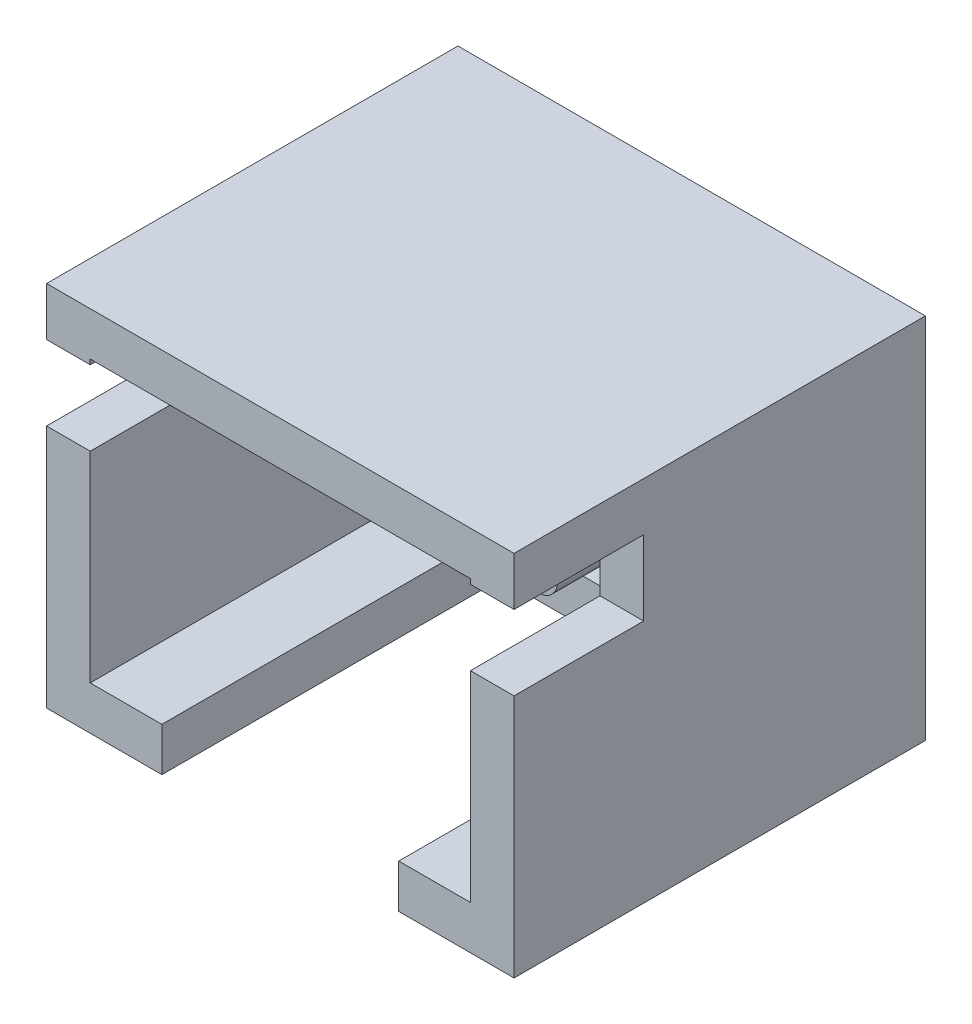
SolidWorks part; units mm, degrees
ref_plane "Face" through (0, 0, 0) normal (0, 0, 1) x (1, 0, 0)
ref_plane "Dessus" through (0, 0, 0) normal (0, 1, 0) x (1, 0, 0)
ref_plane "Droite" through (0, 0, 0) normal (1, 0, 0) x (0, 0, -1)
sketch "Esquisse1" plane through (0, 0, 0) normal (0, 0, 1) x (1, 0, 0)
  line L1 (26.7272, -1.2) -> (34.2272, -1.2)
  line L2 (26.7272, -1.2) -> (26.7272, 4.7)
  line L3 (26.7272, 4.7) -> (34.2272, 4.7)
  line L4 (34.2272, -1.2) -> (34.2272, 4.7)
  dimension "D1" = 5.9
  dimension "D2" = 7.5
extrude "Extrusion1" add sketch "Esquisse1" along normal blind 6.6
shell "Coque1" thickness 0.7
sketch "Esquisse2" plane through (34.2272, 0, 0) normal (1, 0, 0) x (0, 0, -1)
  line L0 (-6.6, -1.2) -> (-6.6, 4.7) construction
  line L1 (-6.6, 2.7202) -> (-4.5204, 2.7202)
  line L2 (-6.6, 2.7202) -> (-6.6, 3.9202)
  line L3 (-6.6, 3.9202) -> (-4.5204, 3.9202)
  line L4 (-4.5204, 2.7202) -> (-4.5204, 3.9202)
  line L5 (0, 1.75) -> (-5.6635, 1.75) construction
  line L6 (0, -1.2) -> (0, 4.7) construction
  dimension "D1" = 1.2
  dimension "D2" = 2.0796
extrude "Enlèv. mat.-Extru.1" cut sketch "Esquisse2" against normal through all
sketch "Esquisse3" plane through (0, -1.2, 0) normal (0, -1, 0) x (1, 0, 0)
  line L0 (26.7272, 6.6) -> (34.2272, 6.6) construction
  line L1 (28.5772, 6.6) -> (32.3772, 6.6)
  line L2 (28.5772, 6.6) -> (28.5772, 1.1619)
  line L3 (28.5772, 1.1619) -> (32.3772, 1.1619)
  line L4 (32.3772, 6.6) -> (32.3772, 1.1619)
  line L5 (30.4772, 0) -> (30.4772, 4.8072) construction
  line L6 (26.7272, 0) -> (34.2272, 0) construction
  point P6 (30.4772, 6.6)
  dimension "D1" = 3.8
extrude "Enlèv. mat.-Extru.2" cut sketch "Esquisse3" against normal up to next
sketch "Esquisse4" plane through (0, 0, 0.7) normal (0, 0, 1) x (1, 0, 0)
  line L0 (27.4272, 1.75) -> (34.921, 1.75) construction
  line L1 (27.4272, 4) -> (27.4272, -0.5) construction
  line L2 (30.4772, 4) -> (30.4772, 1.339) construction
  line L3 (33.5272, 4) -> (27.4272, 4) construction
  circle A0 centre (29.2203, 1.75) radius 0.3029
  circle A1 centre (31.7203, 1.75) radius 0.3029
  circle A4 centre (34.2203, 1.75) radius 0.3029
  dimension "D1" = 2.5
extrude "Extrusion2" add sketch "Esquisse4" along normal blind 3 and the other way blind 2
